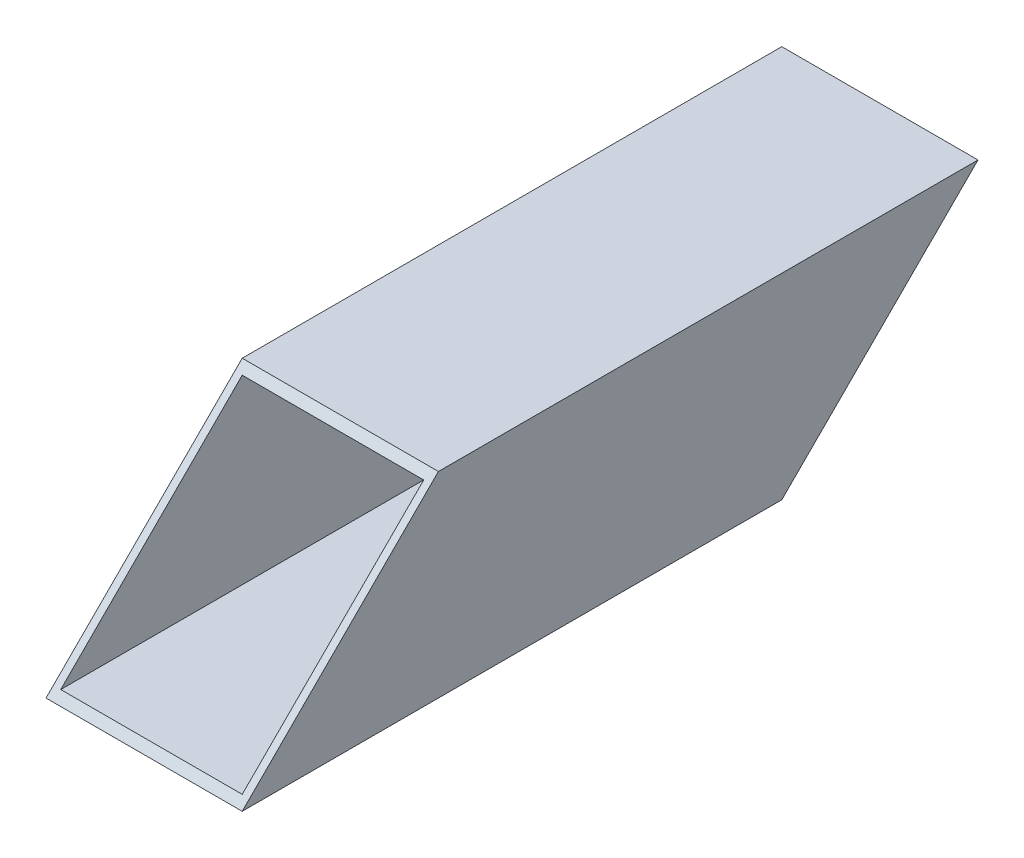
SolidWorks part; units mm, degrees
ref_plane "Plan de face" through (0, 0, 0) normal (0, 0, 1) x (1, 0, 0)
ref_plane "Plan de dessus" through (0, 0, 0) normal (0, 1, 0) x (1, 0, 0)
ref_plane "Plan de droite" through (0, 0, 0) normal (1, 0, 0) x (0, 0, -1)
sketch "Esquisse1" plane through (0, 0, 0) normal (0, 0, 1) x (1, 0, 0)
  line L1 (0, 80) -> (80, 80)
  line L2 (0, 80) -> (0, 0)
  line L3 (0, 0) -> (80, 0)
  line L4 (80, 80) -> (80, 0)
  line L5 (3, 77) -> (77, 77)
  line L6 (3, 77) -> (3, 3)
  line L7 (3, 3) -> (77, 3)
  line L8 (77, 77) -> (77, 3)
  dimension "D1" = 80
  dimension "D2" = 80
  dimension "D3" = 3
  dimension "D4" = 3
  dimension "D5" = 3
  dimension "D6" = 3
extrude "Extrusion1" add sketch "Esquisse1" along normal blind 300
chamfer "Chanfrein1" distance 80 distance2 80 1 edges at (40, 80, 300)
chamfer "Chanfrein3" distance 80 1 edges at (40, 0, 0)
